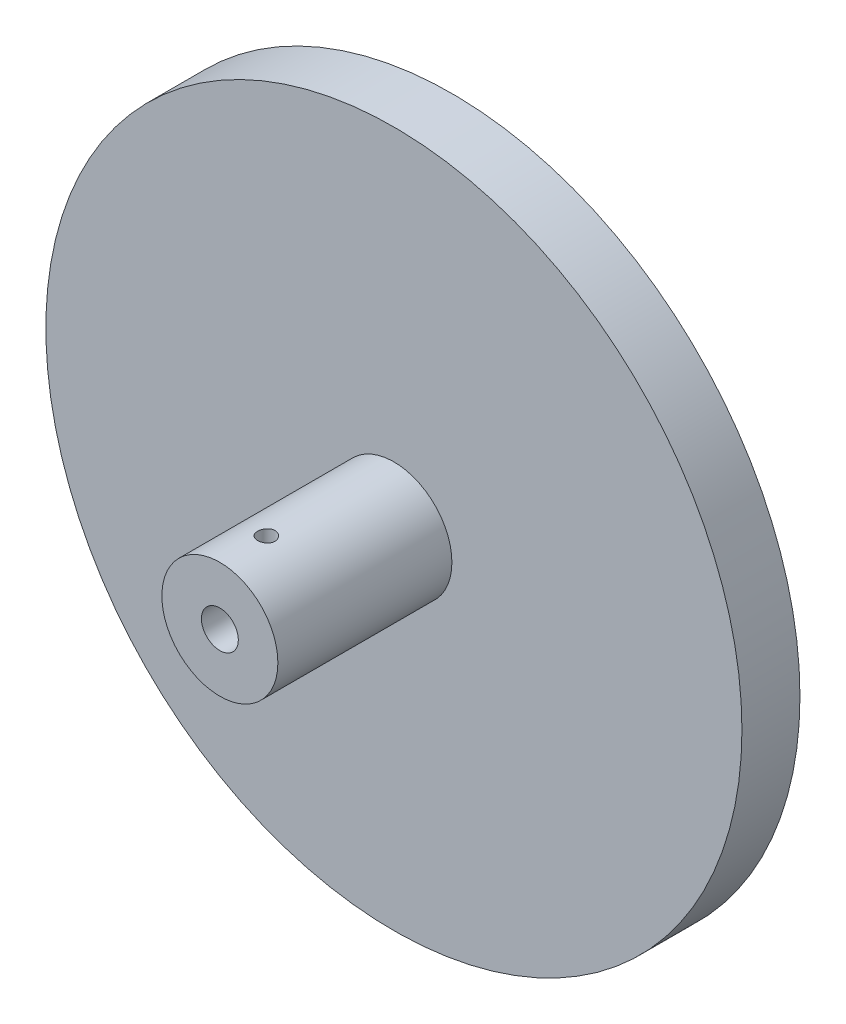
SolidWorks part; units mm, degrees
ref_plane "Front Plane" through (0, 0, 0) normal (0, 0, 1) x (1, 0, 0)
ref_plane "Top Plane" through (0, 0, 0) normal (0, 1, 0) x (1, 0, 0)
ref_plane "Right Plane" through (0, 0, 0) normal (1, 0, 0) x (0, 0, -1)
sketch "Sketch1" plane through (0, 0, 0) normal (0, 0, 1) x (1, 0, 0)
  circle A0 centre (0, 0) radius 60
  point P0 (0, 0)
  dimension "D1" = 120
extrude "Boss-Extrude1" add sketch "Sketch1" along normal blind 10
sketch "Sketch2" plane through (0, 0, 10) normal (0, 0, 1) x (1, 0, 0)
  circle A0 centre (0, 0) radius 10
  dimension "D1" = 20
extrude "Boss-Extrude2" add sketch "Sketch2" along normal blind 30
sketch "Sketch3" plane through (0, 0, 40) normal (0, 0, 1) x (1, 0, 0)
  circle A0 centre (0, 0) radius 3.18
extrude "Cut-Extrude1" cut sketch "Sketch3" against normal blind 30
ref_plane "Plane1" through (0, 15, 0) normal (0, 1, 0) x (1, 0, 0)
sketch "Sketch4" plane through (0, 15, 0) normal (0, 1, 0) x (1, 0, 0)
  line L0 (-10, -40) -> (10, -40) construction
  circle A0 centre (0, -32) radius 1.5
  dimension "D1" = 3
  dimension "D2" = 8
extrude "Cut-Extrude2" cut sketch "Sketch4" against normal up to next
